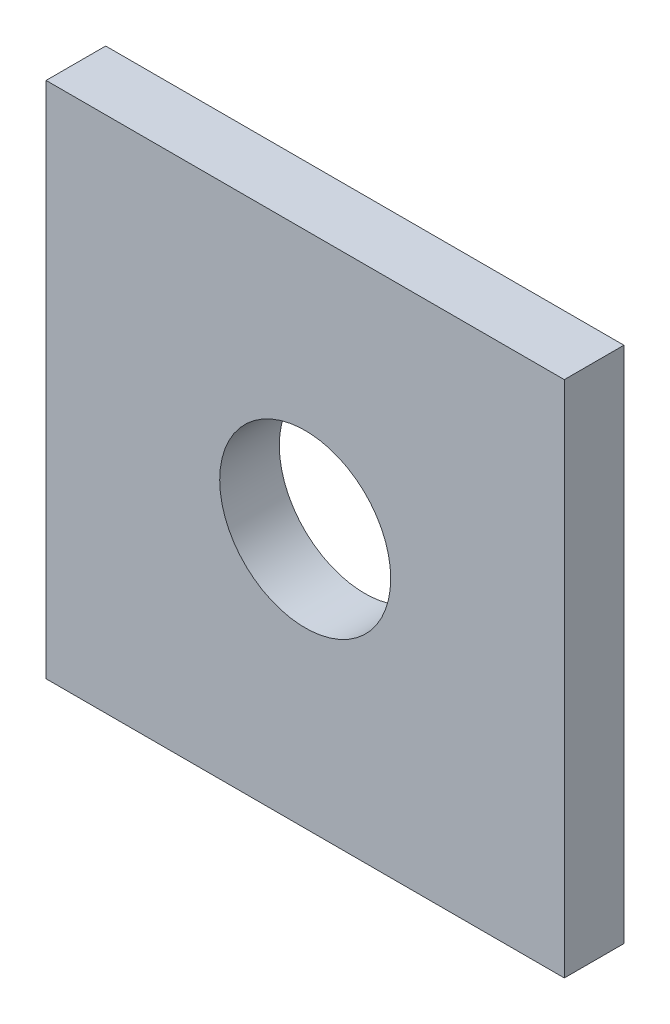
SolidWorks part; units mm, degrees
ref_plane "Front Plane" through (0, 0, 0) normal (0, 0, 1) x (1, 0, 0)
ref_plane "Top Plane" through (0, 0, 0) normal (0, 1, 0) x (1, 0, 0)
ref_plane "Right Plane" through (0, 0, 0) normal (1, 0, 0) x (0, 0, -1)
other "Configuration Table"
sketch "BodySke" plane through (0, 0, 0) normal (0, 0, 1) x (1, 0, 0)
  line L0 (0, 0) -> (0, 20) construction
  line L1 (-10, 0) -> (10, 0)
  line L2 (10, 0) -> (10, 20)
  line L3 (10, 20) -> (-10, 20)
  line L4 (-10, 20) -> (-10, 0)
  line L5 (-10, 10) -> (10, 10) construction
  circle A0 centre (0, 10) radius 3.3
  dimension "Inner_dia" = 6.6
  dimension "Side_Length" = 20
extrude "BaseBody" add sketch "BodySke" along normal blind 2.3
